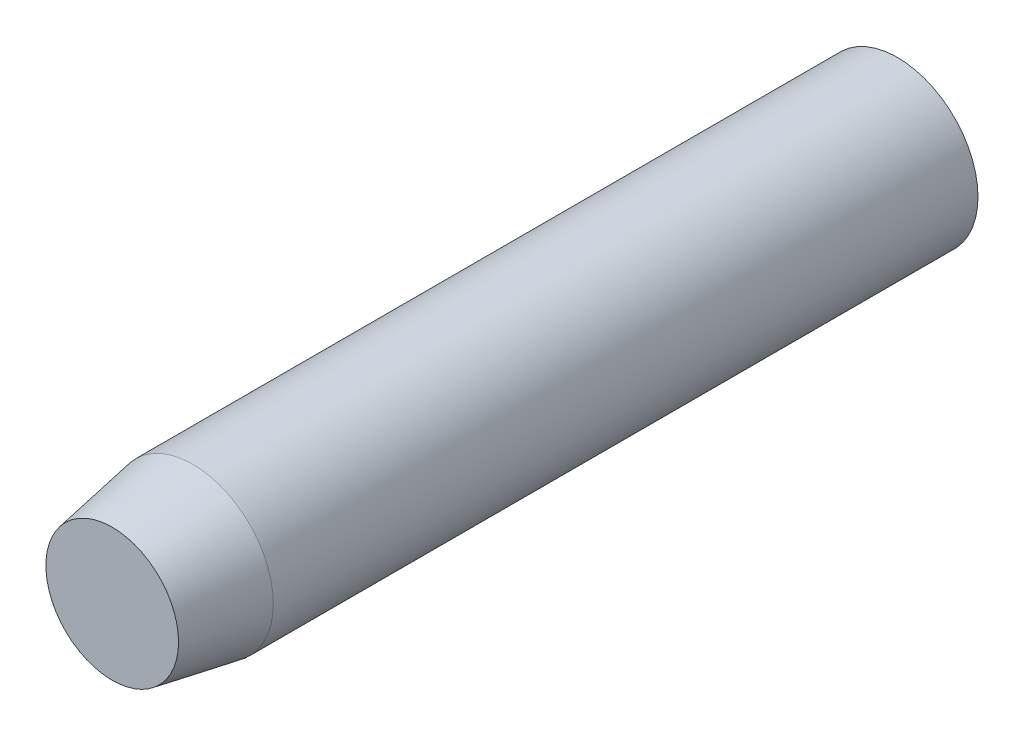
SolidWorks part; units mm, degrees
ref_plane "Face" through (0, 0, 0) normal (0, 0, 1) x (1, 0, 0)
ref_plane "Dessus" through (0, 0, 0) normal (0, 1, 0) x (1, 0, 0)
ref_plane "Droite" through (0, 0, 0) normal (1, 0, 0) x (0, 0, -1)
sketch "Esquisse1" plane through (0, 0, 0) normal (0, 0, 1) x (1, 0, 0)
  circle A0 centre (0, 0) radius 2
  dimension "D1" = 4
extrude "Extrusion1" add sketch "Esquisse1" along normal blind 19.5
chamfer "Chanfrein1" distance 2 angle 10
dome "Dôme1" faces to dome 1 distance 0.5 parameters "D1"=0.5
